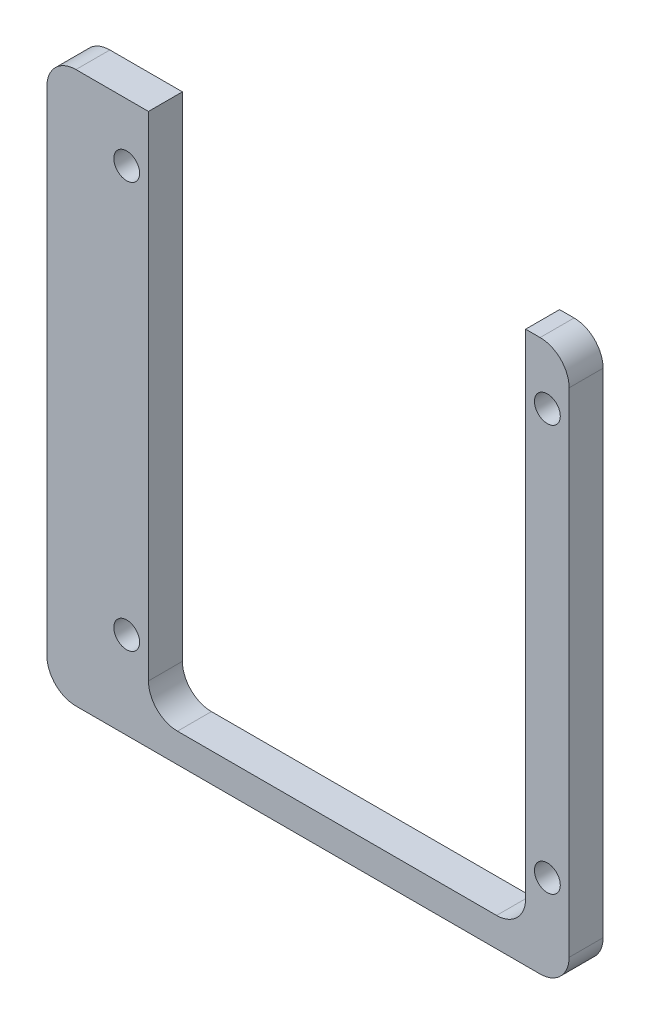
SolidWorks part; units mm, degrees
ref_plane "Front Plane" through (0, 0, 0) normal (0, 0, 1) x (1, 0, 0)
ref_plane "Top Plane" through (0, 0, 0) normal (0, 1, 0) x (1, 0, 0)
ref_plane "Right Plane" through (0, 0, 0) normal (1, 0, 0) x (0, 0, -1)
sketch "Sketch1" plane through (0, 0, 0) normal (0, 0, 1) x (1, 0, 0)
  line L1 (-22.86, 24.13) -> (22.86, 24.13)
  line L2 (-22.86, 24.13) -> (-22.86, -24.13)
  line L3 (-22.86, -24.13) -> (22.86, -24.13)
  line L4 (22.86, 24.13) -> (22.86, -24.13)
  line L5 (-22.86, 24.13) -> (22.86, -24.13) construction
  line L6 (-22.86, -24.13) -> (22.86, 24.13) construction
  point P0 (0, 0)
  dimension "D1" = 45.72
  dimension "D2" = 48.26
extrude "Boss-Extrude1" add sketch "Sketch1" along normal blind 2.9718
sketch "Sketch2" plane through (0, 0, 2.9718) normal (0, 0, 1) x (1, 0, 0)
  line L0 (2.54, 24.13) -> (2.54, -24.13) construction
  line L1 (22.86, 24.13) -> (-22.86, 24.13) construction
  line L2 (-22.86, -24.13) -> (22.86, -24.13) construction
  line L4 (0, -24.13) -> (0, 25.5487) construction
  line L5 (-13.97, 24.13) -> (19.05, 24.13)
  line L6 (-13.97, 24.13) -> (-13.97, -21.59)
  line L7 (-13.97, -21.59) -> (19.05, -21.59)
  line L8 (19.05, 24.13) -> (19.05, -21.59)
  line L9 (-13.97, 24.13) -> (19.05, -21.59) construction
  line L10 (-13.97, -21.59) -> (19.05, 24.13) construction
  point P8 (2.54, 1.27)
  dimension "D1" = 2.54
  dimension "D2" = 33.02
  dimension "D3" = 45.72
  dimension "D4" = 22.86
extrude "Cut-Extrude1" cut sketch "Sketch2" against normal through all
hole_wizard "#2 Clearance Hole1" positions "Sketch3" profile "Sketch4" hole size "#2" standard "ANSI Inch"
sketch "Sketch3" plane through (0, 0, 2.9718) normal (0, 0, 1) x (1, 0, 0)
  line L0 (20.955, 24.13) -> (20.955, -24.13) construction
  line L1 (22.86, 24.13) -> (19.05, 24.13) construction
  line L2 (-22.86, -24.13) -> (22.86, -24.13) construction
  line L5 (-15.875, 24.13) -> (-15.875, -24.13) construction
  line L6 (-13.97, 24.13) -> (-22.86, 24.13) construction
  line L8 (-13.97, 24.13) -> (-13.97, -21.59) construction
  line L9 (-22.86, 19.05) -> (22.86, 19.05) construction
  line L10 (-22.86, 24.13) -> (-22.86, -24.13) construction
  line L11 (22.86, -24.13) -> (22.86, 24.13) construction
  line L13 (-22.86, -16.51) -> (22.86, -16.51) construction
  line L15 (-13.97, -21.59) -> (19.05, -21.59) construction
  point P32 (-15.875, 19.05)
  point P34 (-15.875, -16.51)
  point P36 (20.955, 19.05)
  point P38 (20.955, -16.51)
  dimension "D1" = 1.905
  dimension "D2" = 5.08
  dimension "D3" = 5.08
sketch "Sketch4" plane through (20.955, -16.51, 2.9718) normal (1, 0, 0) x (0, -1, 0)
  line L0 (0, 0) -> (0, 2.9718)
  line L1 (0, 2.9718) -> (1.1303, 2.9718)
  line L2 (1.1303, 2.9718) -> (1.1303, 0)
  line L5 (1.1303, 0) -> (0, 0)
  line L11 (0, -6.35) -> (0, 107.95) construction
  dimension "Thru Hole Dia." = 2.2606
  dimension "Thru Hole Depth" = 2.9718
fillet "Fillet1" radius 2.54 6 edges at (22.86, -24.13, 1.4859) (-22.86, -24.13, 1.4859) (-22.86, 24.13, 1.4859) (22.86, 24.13, 1.4859) (19.05, -21.59, 1.4859) (-13.97, -21.59, 1.4859)
sketch "Sketch5" plane through (0, 0, 2.9718) normal (0, 0, 1) x (1, 0, 0)
  line L16 (-20.32, -24.2316) -> (20.32, -24.2316)
  line L17 (22.9616, -21.59) -> (22.9616, 21.59)
  line L18 (20.32, 24.2316) -> (18.9484, 24.2316)
  line L19 (18.9484, 24.2316) -> (18.9484, -19.05)
  line L20 (16.51, -21.4884) -> (-11.43, -21.4884)
  line L21 (-13.8684, -19.05) -> (-13.8684, 24.2316)
  line L22 (-13.8684, 24.2316) -> (-20.32, 24.2316)
  line L23 (-22.9616, 21.59) -> (-22.9616, -21.59)
  line L24 (-20.32, -24.2316) -> (20.32, -24.2316)
  line L25 (22.9616, -21.59) -> (22.9616, 21.59)
  line L26 (20.32, 24.2316) -> (18.9484, 24.2316)
  line L27 (18.9484, 24.2316) -> (18.9484, -19.05)
  line L28 (16.51, -21.4884) -> (-11.43, -21.4884)
  line L29 (-13.8684, -19.05) -> (-13.8684, 24.2316)
  line L30 (-13.8684, 24.2316) -> (-20.32, 24.2316)
  line L31 (-22.9616, 21.59) -> (-22.9616, -21.59)
  circle A8 centre (-15.875, 19.05) radius 1.0287
  circle A9 centre (-15.875, 19.05) radius 1.0287
  circle A11 centre (-15.875, -16.51) radius 1.0287
  arc A12 (20.32, -24.2316) -> (22.9616, -21.59) centre (20.32, -21.59) ccw
  arc A13 (22.9616, 21.59) -> (20.32, 24.2316) centre (20.32, 21.59) ccw
  arc A14 (16.51, -21.4884) -> (18.9484, -19.05) centre (16.51, -19.05) ccw
  arc A15 (-13.8684, -19.05) -> (-11.43, -21.4884) centre (-11.43, -19.05) ccw
  arc A16 (-20.32, 24.2316) -> (-22.9616, 21.59) centre (-20.32, 21.59) ccw
  arc A17 (-22.9616, -21.59) -> (-20.32, -24.2316) centre (-20.32, -21.59) ccw
  arc A18 (20.32, -24.2316) -> (22.9616, -21.59) centre (20.32, -21.59) ccw
  arc A19 (22.9616, 21.59) -> (20.32, 24.2316) centre (20.32, 21.59) ccw
  arc A20 (16.51, -21.4884) -> (18.9484, -19.05) centre (16.51, -19.05) ccw
  arc A21 (-13.8684, -19.05) -> (-11.43, -21.4884) centre (-11.43, -19.05) ccw
  arc A22 (-20.32, 24.2316) -> (-22.9616, 21.59) centre (-20.32, 21.59) ccw
  arc A23 (-22.9616, -21.59) -> (-20.32, -24.2316) centre (-20.32, -21.59) ccw
  circle A24 centre (-15.875, -16.51) radius 1.0287
  circle A26 centre (20.955, 19.05) radius 1.0287
  circle A27 centre (20.955, 19.05) radius 1.0287
  circle A29 centre (20.955, -16.51) radius 1.0287
  circle A30 centre (20.955, -16.51) radius 1.0287
equation "\"t\"= .117in'plywood thickness"
equation "\"kerf\" = .004in'laser cutter kerf"
equation "\"D1@Boss-Extrude1\"=\"t\""
equation "\"D2@Sketch5\"=\"kerf\""
equation "\"D3@Sketch5\"=\"kerf\""
equation "\"D1@Sketch5\"=\"kerf\""
equation "\"D5@Sketch5\"=\"kerf\""
equation "\"D4@Sketch5\"=\"kerf\""
